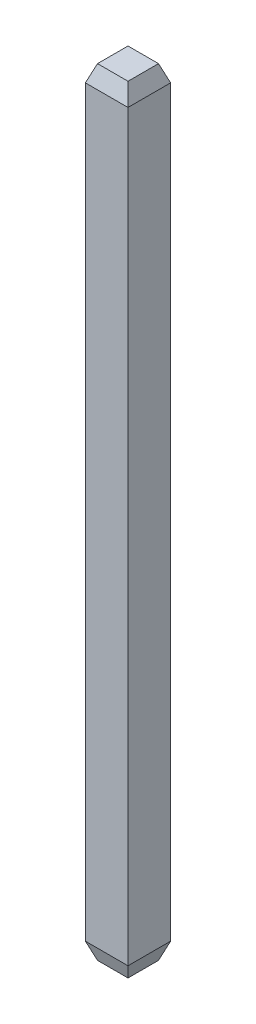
SolidWorks part; units mm, degrees
ref_plane "Спереди" through (0, 0, 0) normal (0, 0, 1) x (1, 0, 0)
ref_plane "Сверху" through (0, 0, 0) normal (0, 1, 0) x (1, 0, 0)
ref_plane "Справа" through (0, 0, 0) normal (1, 0, 0) x (0, 0, -1)
other "Configuration Table"
sketch "Эскиз1" plane through (0, 0, 0) normal (0, 1, 0) x (1, 0, 0)
  line L1 (-0.32, -0.32) -> (0.32, -0.32)
  line L2 (-0.32, -0.32) -> (-0.32, 0.32)
  line L3 (-0.32, 0.32) -> (0.32, 0.32)
  line L4 (0.32, -0.32) -> (0.32, 0.32)
  line L5 (0, 0.32) -> (0, -0.32) construction
  line L6 (-0.32, 0) -> (0.32, 0) construction
  point P0 (0, 0)
  dimension "D1" = 0.64
extrude "Бобышка-Вытянуть1" add sketch "Эскиз1" along normal blind 11.66
sketch "Эскиз2" plane through (0, 11.66, 0) normal (0, 1, 0) x (1, 0, 0)
  line L1 (0.32, 0.32) -> (-0.32, 0.32)
  line L2 (0.32, 0.32) -> (0.32, -0.32)
  line L3 (0.32, -0.32) -> (-0.32, -0.32)
  line L4 (-0.32, 0.32) -> (-0.32, -0.32)
  line L5 (0, -0.32) -> (0, 0.32) construction
  line L6 (0.32, 0) -> (-0.32, 0) construction
  point P0 (0, 0)
chamfer "Фаска1" distance 0.25 angle 20 4 edges at (0.32, 11.66, 0) (0, 11.66, 0.32) (-0.32, 11.66, 0) (0, 11.66, -0.32)
chamfer "Фаска2" distance 0.25 angle 20 4 edges at (0, 0, -0.32) (-0.32, 0, 0) (0, 0, 0.32) (0.32, 0, 0)
